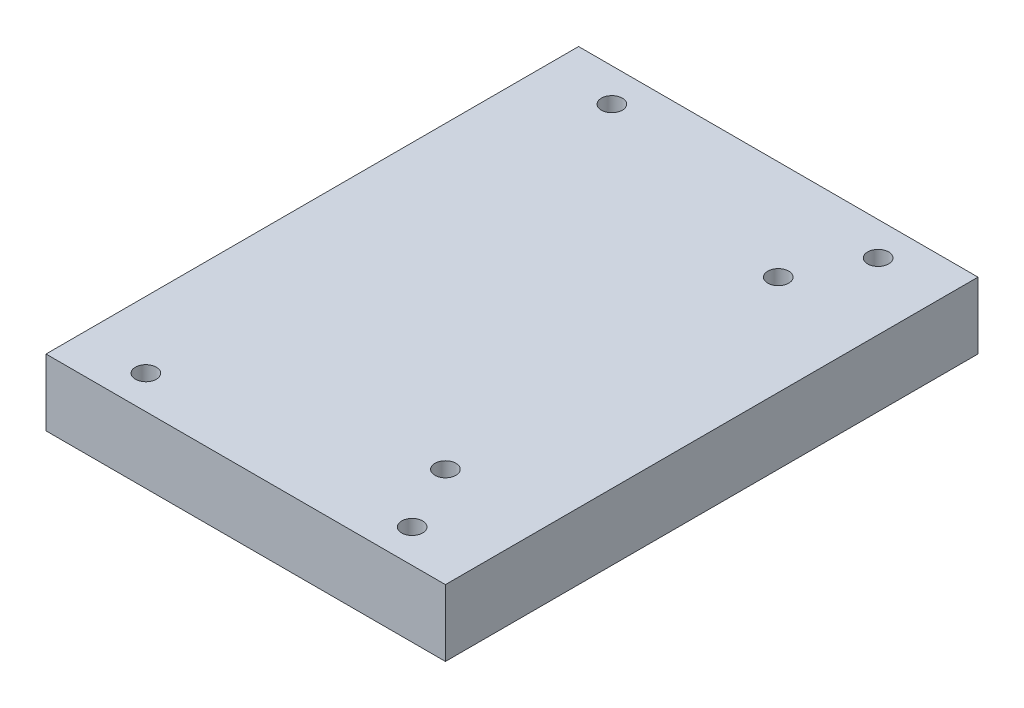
SolidWorks part; units mm, degrees
ref_plane "Front Plane" through (0, 0, 0) normal (0, 0, 1) x (1, 0, 0)
ref_plane "Top Plane" through (0, 0, 0) normal (0, 1, 0) x (1, 0, 0)
ref_plane "Right Plane" through (0, 0, 0) normal (1, 0, 0) x (0, 0, -1)
sketch "Sketch1" plane through (0, 0, 0) normal (0, 1, 0) x (1, 0, 0)
  line L1 (-123.989, 27.4708) -> (-47.789, 27.4708)
  line L2 (-123.989, 27.4708) -> (-123.989, -74.1292)
  line L3 (-123.989, -74.1292) -> (-47.789, -74.1292)
  line L4 (-47.789, 27.4708) -> (-47.789, -74.1292)
  dimension "D1" = 101.6
  dimension "D2" = 76.2
extrude "Boss-Extrude1" add sketch "Sketch1" along normal blind 12.7
sketch "Sketch2" plane through (0, 12.7, 0) normal (0, 1, 0) x (-1, 0, 0)
  line L0 (123.989, 74.1292) -> (47.789, 74.1292) construction
  line L3 (47.789, 74.1292) -> (47.789, -27.4708) construction
  line L4 (123.989, -27.4708) -> (123.989, 74.1292) construction
  line L5 (47.789, -27.4708) -> (123.989, -27.4708) construction
  circle A0 centre (111.289, -21.1208) radius 2
  circle A1 centre (60.489, -21.1208) radius 2
  circle A2 centre (60.489, 67.7792) radius 2
  circle A3 centre (111.289, 67.7792) radius 2
  dimension "D9" = 4
  dimension "D10" = 4
  dimension "D11" = 4
  dimension "D12" = 4
  dimension "D1" = 6.35
  dimension "D2" = 6.35
  dimension "D3" = 12.7
  dimension "D4" = 12.7
  dimension "D5" = 6.35
  dimension "D6" = 12.7
  dimension "D7" = 6.35
  dimension "D8" = 12.7
hole_wizard "Ø4.0 (4) Diameter Hole1" positions "3DSketch1" profile "Sketch4" hole size "Ø4.0" standard "Ansi Metric"
sketch3d "3DSketch1"
  point P0 (-111.289, 12.7, 67.7792)
  point P3 (-111.289, 12.7, -21.1208)
  point P6 (-60.489, 12.7, -21.1208)
  point P9 (-60.489, 12.7, 67.7792)
sketch "Sketch4" plane through (-111.289, 12.7, 67.7792) normal (1, 0, 0) x (0, 0, 1)
  line L0 (0, 0) -> (0, 13.9017)
  line L1 (0, 13.9017) -> (2, 12.7)
  line L2 (2, 12.7) -> (2, 0)
  line L5 (2, 0) -> (0, 0)
  line L10 (0, 13.9017) -> (-2, 12.7) construction
  line L11 (0, -6.35) -> (0, 107.95) construction
  dimension "Hole Dia." = 4
  dimension "Hole Depth" = 12.7
  dimension "Drill Angle" = 118
sketch "Sketch5" plane through (0, 12.7, 0) normal (0, 1, 0) x (1, 0, 0)
  line L0 (-47.789, -74.1292) -> (-47.789, 27.4708) construction
  line L1 (-123.989, -74.1292) -> (-47.789, -74.1292) construction
  line L2 (-47.789, 27.4708) -> (-123.989, 27.4708) construction
  circle A0 centre (-66.839, 8.4208) radius 2
  circle A1 centre (-66.839, -55.0792) radius 2
  dimension "D1" = 4
  dimension "D2" = 4
  dimension "D3" = 19.05
  dimension "D4" = 19.05
  dimension "D5" = 19.05
  dimension "D6" = 19.05
extrude "Cut-Extrude1" cut sketch "Sketch5" against normal through all
